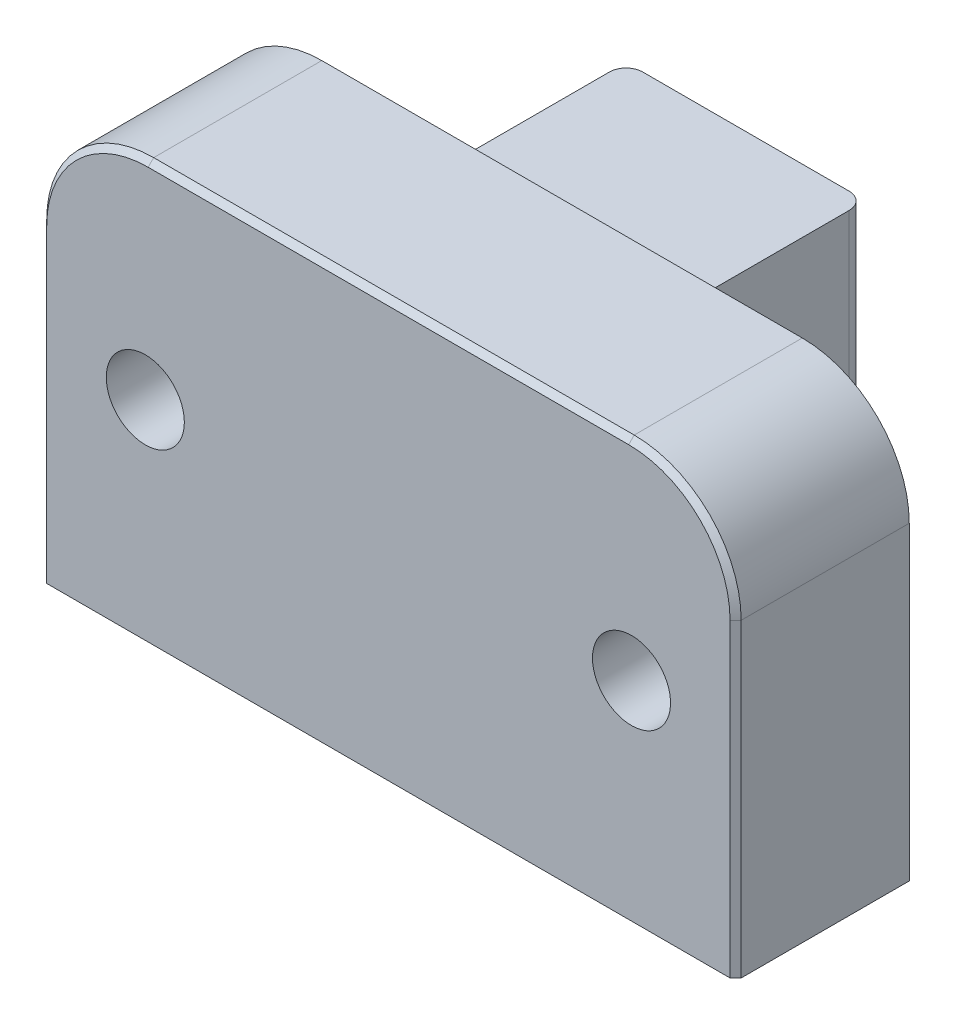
SolidWorks part; units mm, degrees
ref_plane "Front Plane" through (0, 0, 0) normal (0, 0, 1) x (1, 0, 0)
ref_plane "Top Plane" through (0, 0, 0) normal (0, 1, 0) x (1, 0, 0)
ref_plane "Right Plane" through (0, 0, 0) normal (1, 0, 0) x (0, 0, -1)
sketch "Sketch1" plane through (0, 0, 0) normal (0, 1, 0) x (1, 0, 0)
  line L0 (0, 42.6503) -> (0, -22.9644) construction
  line L1 (0, -55) -> (0, 55) construction
  line L2 (-55, 0) -> (55, 0) construction
  line L3 (-31.7436, 0) -> (-10.9601, 0)
  line L4 (-31.7436, 0) -> (-31.7436, -15.875)
  line L5 (-31.7436, -15.875) -> (31.7437, -15.875)
  line L6 (31.7437, 0) -> (31.7437, -15.875)
  line L7 (10.9601, 0) -> (31.7437, 0)
  line L8 (-10.9601, 16.8148) -> (-10.9601, 0)
  line L9 (-10.9601, 16.8148) -> (10.9601, 16.8148)
  line L10 (10.9601, 16.8148) -> (10.9601, 0)
  dimension "D1" = 63.4873
  dimension "D2" = 31.7436
  dimension "D3" = 15.875
  dimension "D4" = 21.9202
  dimension "D5" = 10.9601
  dimension "D6" = 16.8148
extrude "Extrude1" add sketch "Sketch1" along normal blind 38.1
sketch "Sketch3" plane through (0, 0, 0) normal (1, 0, 0) x (0, 0, -1)
  line L0 (0, 55) -> (0, -55) construction
  line L1 (50.8, -5.329) -> (0, -5.329)
  line L2 (50.8, -5.329) -> (50.8, 3.048)
  line L3 (50.8, 3.048) -> (0, 3.048)
  line L4 (0, -5.329) -> (0, 3.048)
  line L5 (50.8, 35.052) -> (0, 35.052)
  line L6 (50.8, 35.052) -> (50.8, 42.672)
  line L7 (50.8, 42.672) -> (0, 42.672)
  line L8 (0, 35.052) -> (0, 42.672)
  line L9 (0, 38.1) -> (0, 0) construction
  line L10 (0, 38.1) -> (16.8148, 38.1) construction
  line L11 (55, 0) -> (-55, 0) construction
  dimension "D1" = 3.048
  dimension "D2" = 3.048
  dimension "D3" = 7.62
  dimension "D4" = 50.8
  dimension "D5" = 50.8
  dimension "D6" = 5.329
extrude "Cut-Extrude2" cut sketch "Sketch3" against normal mid plane 50.8
fillet "Fillet2" radius 1.524 2 edges at (10.9601, 19.05, -16.8148) (-10.9601, 19.05, -16.8148)
fillet "Fillet3" radius 0.7874 2 edges at (-10.9601, 19.05, 0) (10.9601, 19.05, 0)
fillet "Fillet4" radius 9.779 2 edges at (31.7437, 38.1, 7.9375) (-31.7436, 38.1, 7.9375)
ref_plane "Plane1" through (0, 19.05, 0) normal (0, 1, 0) x (-1, 0, 0)
sketch "Sketch4" plane through (0, 19.05, 0) normal (0, 1, 0) x (-1, 0, 0)
  line L0 (22.225, 26.8652) -> (22.225, -2.0432) construction
  line L1 (22.225, 15.875) -> (18.6563, 15.875)
  line L2 (18.6563, 15.875) -> (18.6563, 6.7564)
  line L3 (18.6563, 6.7564) -> (17.0688, 6.7564)
  line L4 (17.0688, 6.7564) -> (17.0688, 0)
  line L5 (17.0688, 0) -> (22.225, 0)
  line L6 (22.225, 0) -> (22.225, 15.875)
  line L7 (-31.7437, 0) -> (31.7436, 0) construction
  line L8 (31.7436, 15.875) -> (-31.7437, 15.875) construction
  line L10 (0, 55) -> (0, -55) construction
  dimension "D1" = 10.3124
  dimension "D2" = 6.7564
  dimension "D3" = 7.1374
  dimension "D4" = 22.225
revolve "Cut-Revolve1" cut sketch "Sketch4" angle 360 about L0
mirror "Mirror1" about plane through (0, 0, 0) normal (1, 0, 0) of "Cut-Revolve1"
chamfer "Chamfer1" distance 0.508 angle 45 5 edges at (-31.7436, 14.1605, 15.875) (-28.8794, 35.2358, 15.875) (0, 38.1, 15.875) (28.8794, 35.2358, 15.875) (31.7437, 14.1605, 15.875)
